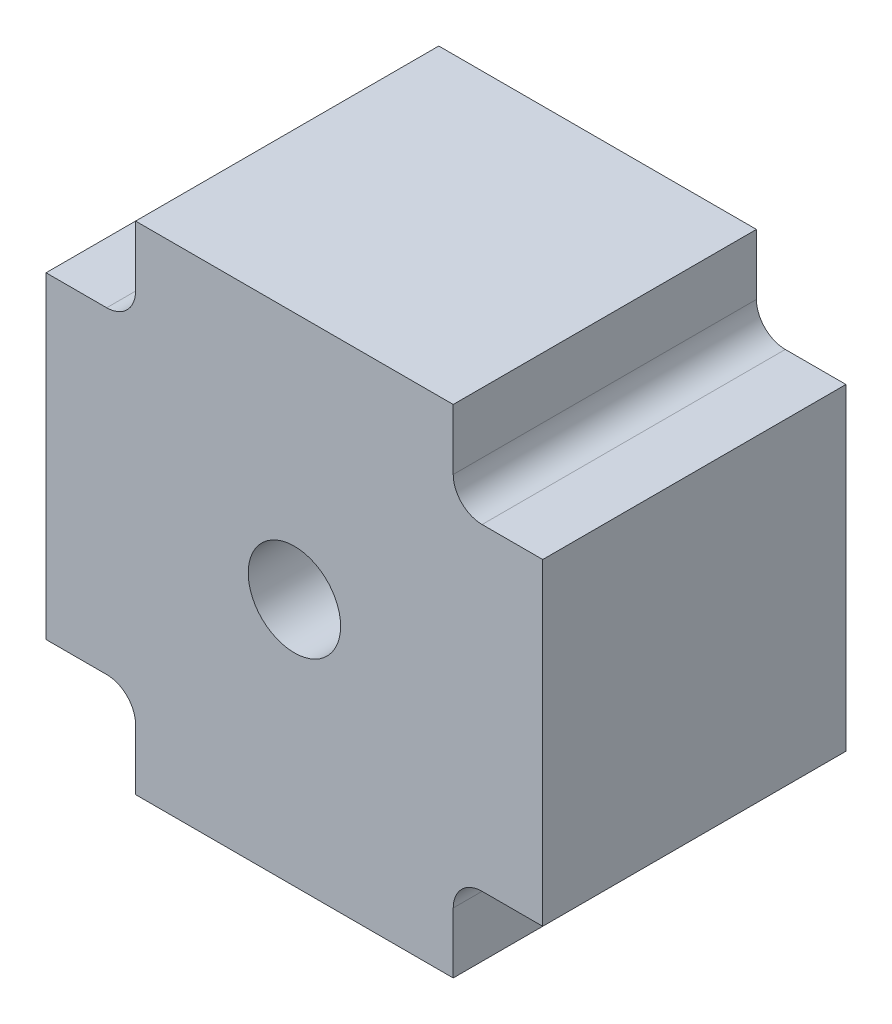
SolidWorks part; units mm, degrees
ref_plane "前视" through (0, 0, 0) normal (0, 0, 1) x (1, 0, 0)
ref_plane "上视" through (0, 0, 0) normal (0, 1, 0) x (1, 0, 0)
ref_plane "右视" through (0, 0, 0) normal (1, 0, 0) x (0, 0, -1)
sketch "草图1" plane through (0, 0, 0) normal (0, 0, 1) x (1, 0, 0)
  line L0 (-27.5, 27.5) -> (-43, 27.5)
  line L1 (27.5, -43) -> (-27.5, -43)
  line L2 (43, -27.5) -> (43, 27.5)
  line L3 (27.5, 43) -> (-27.5, 43)
  line L4 (-43, -27.5) -> (-43, 27.5)
  line L5 (27.5, -27.5) -> (-43, 43) construction
  line L6 (43, 43) -> (-43, -43) construction
  line L7 (43, -27.5) -> (27.5, -27.5)
  line L9 (43, 27.5) -> (27.5, 27.5)
  line L11 (43, -27.5) -> (-43, 27.5) construction
  line L12 (43, 27.5) -> (-43, -27.5) construction
  line L14 (27.5, -43) -> (27.5, -27.5)
  line L16 (-27.5, -43) -> (-27.5, -27.5)
  line L17 (27.5, -43) -> (-27.5, 43) construction
  line L18 (27.5, 43) -> (-27.5, -43) construction
  line L19 (-27.5, 27.5) -> (-27.5, 43)
  line L20 (-27.5, -27.5) -> (-43, -27.5)
  line L21 (27.5, 27.5) -> (27.5, 43)
  point P0 (0, 0)
  point P6 (0, 0)
  point P11 (0, 0)
  dimension "D1" = 86
  dimension "D2" = 86
  dimension "D3" = 55
  dimension "D4" = 55
extrude "凸台-拉伸1" add sketch "草图1" along normal blind 52.5
fillet "圆角1" radius 5 1 edges at (27.5, 27.5, 26.25)
fillet "圆角2" radius 5 3 edges at (27.5, -27.5, 26.25) (-27.5, -27.5, 26.25) (-27.5, 27.5, 26.25)
sketch "草图2" plane through (0, 0, 52.5) normal (0, 0, 1) x (1, 0, 0)
  circle A0 centre (0, 0) radius 8
extrude "切除-拉伸1" cut sketch "草图2" against normal blind 57
